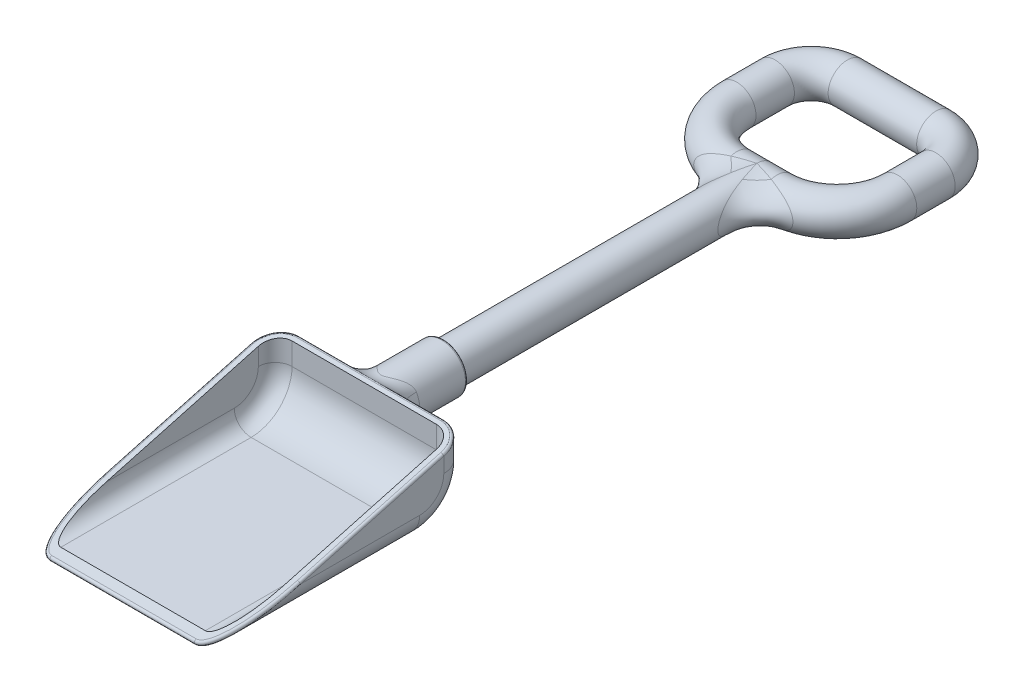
SolidWorks part; units mm, degrees
ref_plane "Front Plane" through (0, 0, 0) normal (0, 0, 1) x (1, 0, 0)
ref_plane "Top Plane" through (0, 0, 0) normal (0, 1, 0) x (1, 0, 0)
ref_plane "Right Plane" through (0, 0, 0) normal (1, 0, 0) x (0, 0, -1)
sketch "Sketch2" plane through (0, 0, 0) normal (1, 0, 0) x (0, 0, -1)
  line L0 (0, 0) -> (-110, 0)
  line L1 (0, 0) -> (0, 30)
  line L2 (0, 30) -> (-110, 0)
extrude "Boss-Extrude2" add sketch "Sketch2" along normal mid plane 80
fillet "Fillet2" radius 20 1 edges at (0, 0, 0)
fillet "Fillet3" radius 10 6 edges at (-40, 25, 0) (-40, 0, 65) (40, 0, 65) (40, 5.8579, 5.8579) (-40, 5.8579, 5.8579) (40, 25, 0)
sketch "Sketch4" plane through (0, 0, 0) normal (0, 0, -1) x (-1, 0, 0)
  circle A0 centre (0, 18.5633) radius 10
extrude "Boss-Extrude3" add sketch "Sketch4" along normal blind 30 and the other way up to body separate body
shell "Shell3" thickness 3
fillet "Fillet5" radius 1 8 edges at (37.0711, 2.9289, 99.2606) (40, 18.6364, 41.6667) (37.0711, 29.2012, 2.9289) (0, 30, 0) (-37.0711, 29.2012, 2.9289) (-40, 18.6364, 41.6667) (-37.0711, 2.9289, 99.2606) (0, 0, 110)
fillet "Fillet6" radius 1 1 edges at (-10, 18.5633, -30)
sketch "Sketch5" plane through (0, 0, -30) normal (0, 0, -1) x (-1, 0, 0)
  circle A3 centre (0, 18.5633) radius 8
  circle A4 centre (0, 18.5633) radius 8
  dimension "D1" = 1
extrude "Boss-Extrude4" add sketch "Sketch5" along normal blind 130
ref_plane "Plane1" through (0, 18.5633, 0) normal (0, 1, 0) x (0, 0, 1)
sketch "Sketch6" plane through (0, 18.5633, 0) normal (0, 1, 0) x (0, 0, 1)
  line L0 (-215.9419, -18.3738) -> (-215.9419, 18.3738)
  line L1 (-200.9419, 33.3738) -> (-185, 33.3738)
  line L2 (-160, -8.3738) -> (-160, 8.3738)
  line L3 (-200.9419, -33.3738) -> (-185, -33.3738)
  arc A4 (-215.9419, 18.3738) -> (-200.9419, 33.3738) centre (-200.9419, 18.3738) cw
  arc A5 (-160, 8.3738) -> (-185, 33.3738) centre (-185, 8.3738) ccw
  arc A6 (-185, -33.3738) -> (-160, -8.3738) centre (-185, -8.3738) ccw
  arc A7 (-200.9419, -33.3738) -> (-215.9419, -18.3738) centre (-200.9419, -18.3738) cw
  point P7 (-195.9419, 0)
sketch "Sketch7" plane through (0, 0, 0) normal (1, 0, 0) x (0, 0, -1)
  line L0 (160, 10.5633) -> (160, 26.5633) construction
  circle A0 centre (160, 18.5633) radius 8
sweep "Sweep1" add profiles "Sketch7" path "Sketch6"
combine bodies "Combine1" operation type add bodies to combine 102 105
fillet "Fillet7" radius 10 2 edges at (0, 28.5633, 0) (-1.4277, 8.6657, 3.5217)
fillet "Fillet8" radius 20 2 edges at (-8, 18.5633, -152) (8, 18.5633, -152)
scale "Scale1" bodies to scale 106 scale about centroid uniform scaling yes scale factor 1.5
